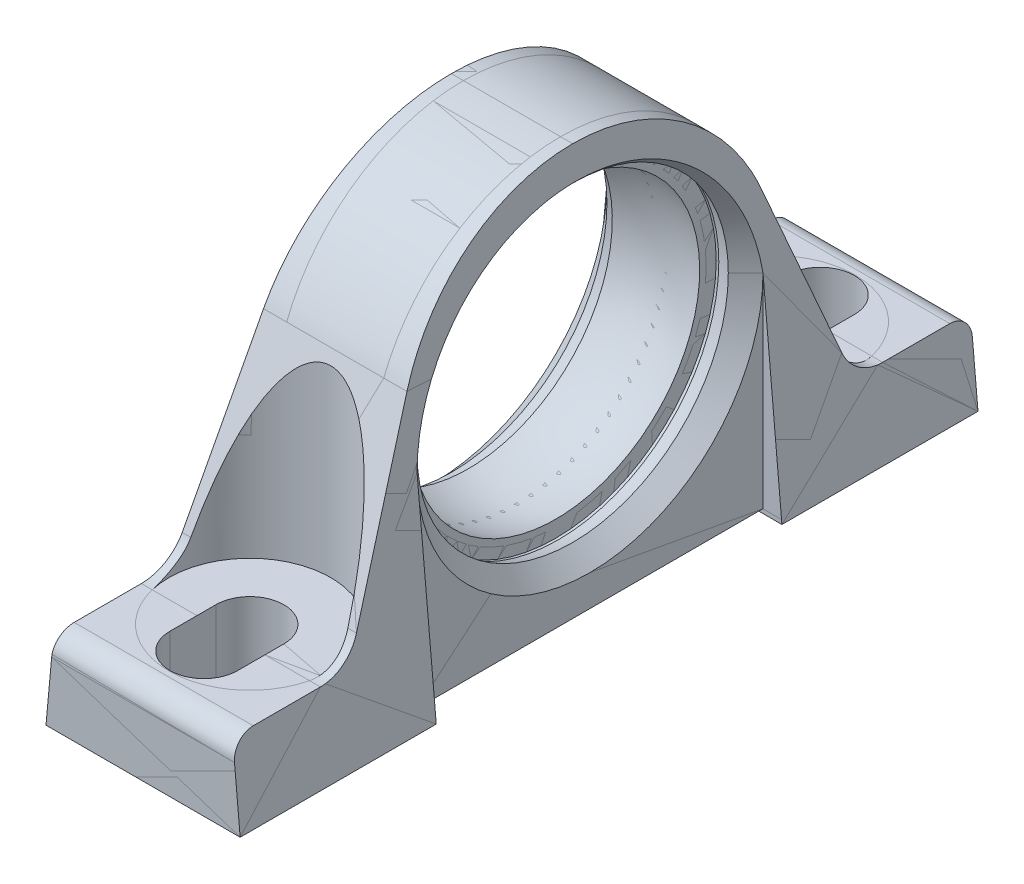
SolidWorks part; units mm, degrees
ref_plane "Face" through (0, 0, 0) normal (0, 0, 1) x (1, 0, 0)
ref_plane "Dessus" through (0, 0, 0) normal (0, 1, 0) x (1, 0, 0)
ref_plane "Droite" through (0, 0, 0) normal (1, 0, 0) x (0, 0, -1)
imported_body "Palier Y (SKF) ø30"
sketch "Esquisse1" plane through (-16.0762, 0, 0) normal (-1, 0, 0) x (0, 0, 1)
  circle A0 centre (42.9, 0) radius 31
  circle A1 centre (42.9, 0) radius 29.6648 construction
  dimension "D1" = 62
extrude "Enlèv. mat.-Extru.1" cut sketch "Esquisse1" against normal through all
